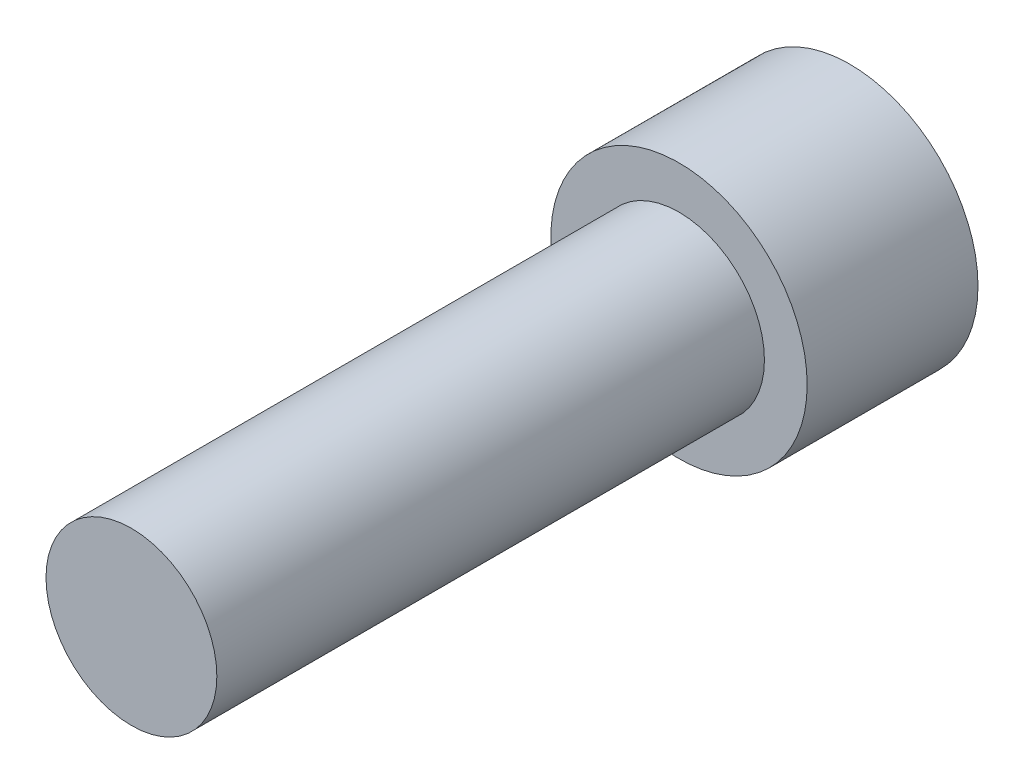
SolidWorks part; units mm, degrees
ref_plane "Front Plane" through (0, 0, 0) normal (0, 0, 1) x (1, 0, 0)
ref_plane "Top Plane" through (0, 0, 0) normal (0, 1, 0) x (1, 0, 0)
ref_plane "Right Plane" through (0, 0, 0) normal (1, 0, 0) x (0, 0, -1)
sketch "Sketch6" plane through (0, 0, 0) normal (1, 0, 0) x (0, 0, -1)
  line L0 (-25.4, 0) -> (22.525, 0) construction
  line L1 (6.538, 0) -> (-6.538, 0) construction
  line L2 (-25.4, 0) -> (-25.4, -3.9624)
  line L3 (-25.4, -3.9624) -> (0, -3.9624)
  line L4 (0, 6.538) -> (0, -6.538) construction
  line L5 (0, -3.9624) -> (0, -5.9436)
  line L6 (0, -5.9436) -> (7.9248, -5.9436)
  line L7 (7.9248, -5.9436) -> (7.9248, 0)
  line L8 (7.9248, 0) -> (-25.4, 0)
  dimension "L" = 25.4
  dimension "H" = 7.9248
  dimension "A" = 11.8872
  dimension "D" = 7.9248
revolve "Revolve1" add sketch "Sketch6" angle 360 about L0
sketch "Sketch7" plane through (0, 0, -7.9248) normal (0, 0, -1) x (-1, 0, 0)
  line L2 (-3.175, 1.8331) -> (-3.175, -1.8331)
  line L4 (-3.175, -1.8331) -> (0, -3.6662)
  line L5 (0, -3.6662) -> (3.175, -1.8331)
  line L6 (3.175, -1.8331) -> (3.175, 1.8331)
  line L7 (3.175, 1.8331) -> (0, 3.6662)
  line L8 (0, 3.6662) -> (-3.175, 1.8331)
  circle A0 centre (0, 0) radius 3.175 construction
  dimension "J" = 6.35
extrude "HEX" cut sketch "Sketch7" against normal blind 4.826
